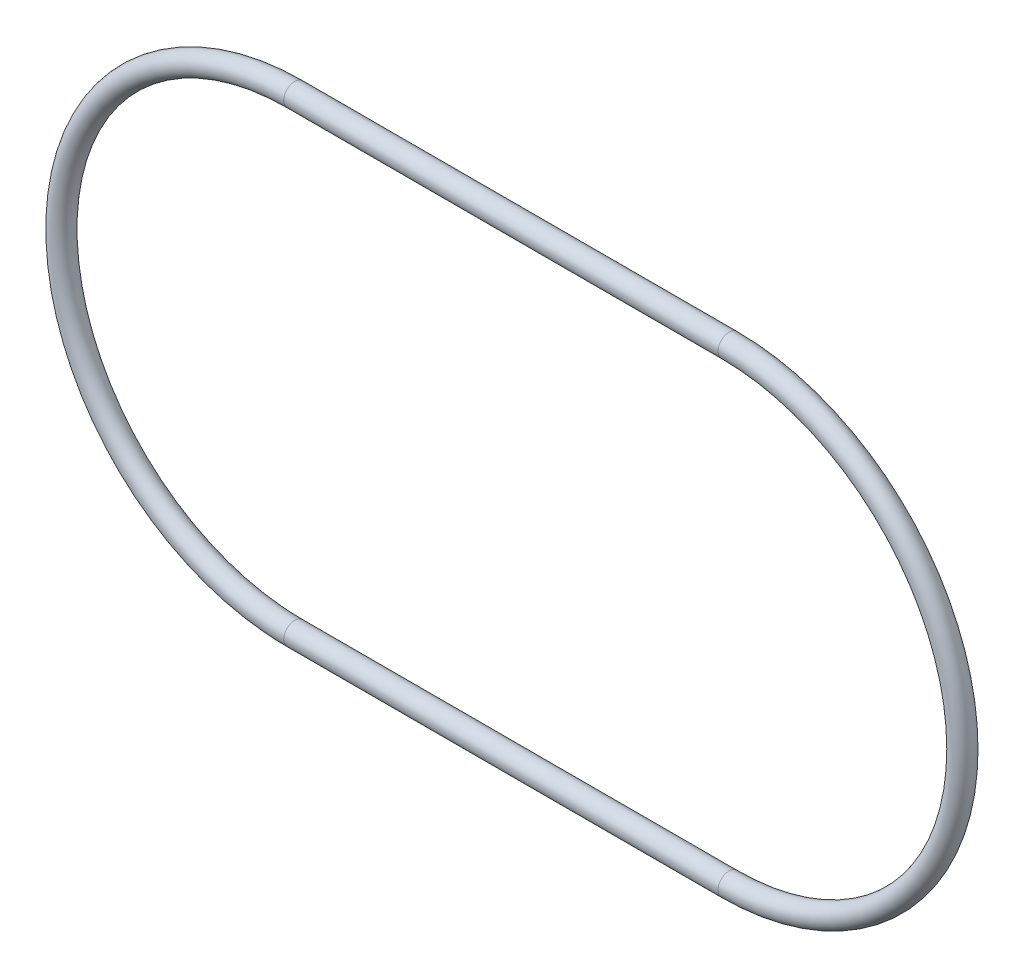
SolidWorks part; units mm, degrees
ref_plane "Plan de face" through (0, 0, 0) normal (0, 0, 1) x (1, 0, 0)
ref_plane "Plan de dessus" through (0, 0, 0) normal (0, 1, 0) x (1, 0, 0)
ref_plane "Plan de droite" through (0, 0, 0) normal (1, 0, 0) x (0, 0, -1)
sketch "Esquisse1" plane through (0, 0, 0) normal (0, 0, 1) x (1, 0, 0)
  line L0 (0, 31.7) -> (59, 31.7)
  line L1 (0, -31.7) -> (59, -31.7)
  arc A0 (0, 31.7) -> (0, -31.7) centre (0, 0) ccw
  arc A1 (59, -31.7) -> (59, 31.7) centre (59, 0) ccw
  dimension "D1" = 31.7
  dimension "D2" = 31.7
  dimension "D3" = 59
sketch "Esquisse2" plane through (0, 0, 0) normal (1, 0, 0) x (0, 0, -1)
  circle A0 centre (0, -31.7) radius 1.5
  dimension "D1" = 3
sweep "Balayage1" add profiles "Esquisse2" path "Esquisse1"
